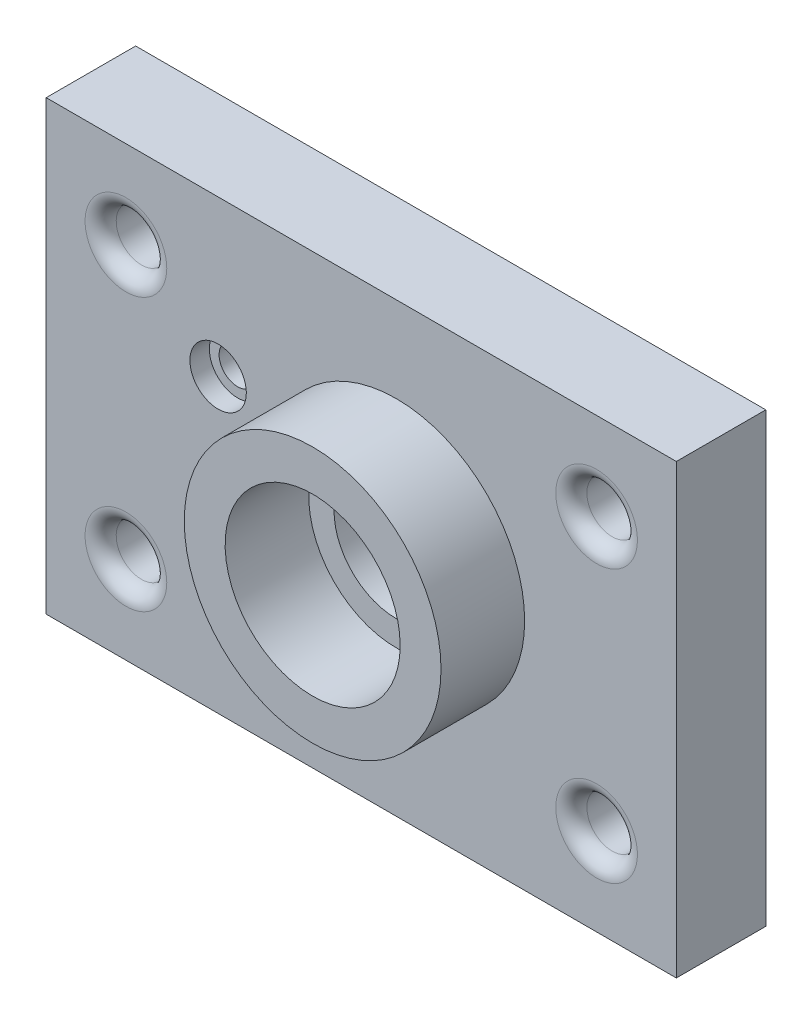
SolidWorks part; units mm, degrees
ref_plane "Front Plane" through (0, 0, 0) normal (0, 0, 1) x (1, 0, 0)
ref_plane "Top Plane" through (0, 0, 0) normal (0, 1, 0) x (1, 0, 0)
ref_plane "Right Plane" through (0, 0, 0) normal (1, 0, 0) x (0, 0, -1)
sketch "Sketch1" plane through (0, 0, 0) normal (0, 0, -1) x (1, 0, 0)
  line L1 (0, 0) -> (162, 0)
  line L2 (0, 0) -> (0, 115)
  line L3 (0, 115) -> (162, 115)
  line L4 (162, 0) -> (162, 115)
  dimension "D1" = 115
  dimension "D2" = 162
extrude "Boss-Extrude1" add sketch "Sketch1" against normal blind 23
sketch "Sketch2" plane through (0, 0, 23) normal (0, 0, 1) x (-1, 0, 0)
  line L0 (0, 115) -> (0, 0) construction
  line L4 (0, 0) -> (-162, 0) construction
  circle A0 centre (-90, 55) radius 33
  circle A1 centre (-90, 55) radius 22.5
  dimension "D1" = 66
  dimension "D4" = 10.5
  dimension "D2" = 90
  dimension "D3" = 55
extrude "Boss-Extrude2" add sketch "Sketch2" along normal blind 21.5
sketch "Sketch4" plane through (0, 0, 23) normal (0, 0, 1) x (-1, 0, 0)
  line L0 (-162, 0) -> (-162, 115) construction
  line L2 (0, 115) -> (0, 0) construction
  line L3 (0, 0) -> (-162, 0) construction
  line L4 (-162, 115) -> (0, 115) construction
  circle A0 centre (-20.5, 92.5) radius 6.5
  circle A1 centre (-20.5, 22.5) radius 6.5
  circle A2 centre (-141.5, 92.5) radius 6.5
  circle A3 centre (-141.5, 22.5) radius 6.5
  circle A4 centre (-44.2, 40) radius 4.75
  circle A5 centre (-44.2, 40) radius 8.65
  dimension "D1" = 13
  dimension "D2" = 9.5
  dimension "D7" = 13
  dimension "D8" = 13
  dimension "D9" = 13
  dimension "D13" = 17.3
  dimension "D3" = 20.5
  dimension "D4" = 20.5
  dimension "D5" = 20.5
  dimension "D6" = 20.5
  dimension "D10" = 22.5
  dimension "D11" = 22.5
  dimension "D12" = 40
  dimension "D14" = 44.2
extrude "Cut-Extrude1" cut sketch "Sketch4" against normal through all contours A4 | A0 | A1 | A3 | A2
fillet "Fillet2" radius 4 1 edges at (20.5, -99, 23)
fillet "Fillet3" radius 4 3 edges at (141.5, -99, 23) (141.5, -29, 23) (20.5, -29, 23)
sketch "Sketch5" plane through (0, 0, 23) normal (0, 0, 1) x (-1, 0, 0)
  circle A0 centre (-44.2, 40) radius 7.25
  dimension "D1" = 14.5
extrude "Cut-Extrude2" cut sketch "Sketch5" against normal blind 5
sketch "Sketch6" plane through (0, 0, 23) normal (0, 0, 1) x (-1, 0, 0)
  line L0 (-90, 55) -> (-90, 0) construction
  line L1 (0, 0) -> (-162, 0) construction
  circle A0 centre (-90, 55) radius 16
  dimension "D1" = 32
extrude "Cut-Extrude3" cut sketch "Sketch6" against normal through all
